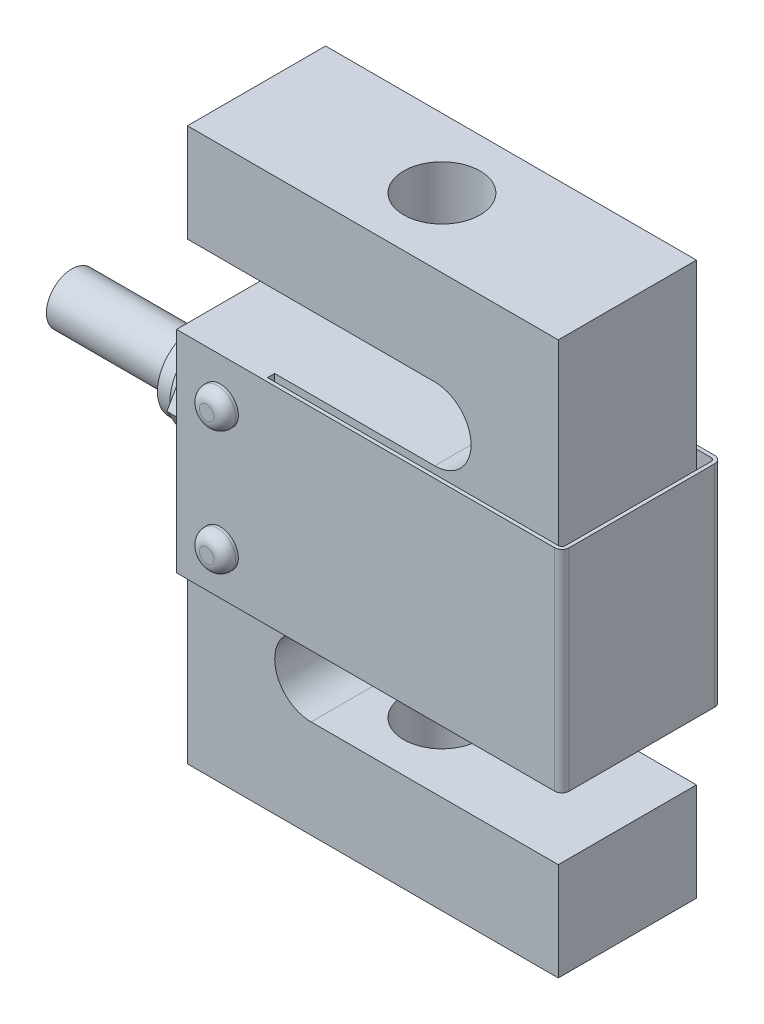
SolidWorks part; units mm, degrees
ref_plane "Plan de face" through (0, 0, 0) normal (0, 0, 1) x (1, 0, 0)
ref_plane "Plan de dessus" through (0, 0, 0) normal (0, 1, 0) x (1, 0, 0)
ref_plane "Plan de droite" through (0, 0, 0) normal (1, 0, 0) x (0, 0, -1)
sketch "Esquisse1" plane through (0, 0, 0) normal (0, 0, 1) x (1, 0, 0)
  line L0 (-25.5, 0) -> (25.5, 0)
  line L1 (25.5, 0) -> (25.5, 13.5)
  line L2 (25.5, 13.5) -> (-8.5, 13.5)
  line L4 (-8.5, 23.5) -> (25.5, 23.5)
  line L5 (25.5, 23.5) -> (25.5, 76)
  line L6 (25.5, 76) -> (-25.5, 76)
  line L7 (-25.5, 76) -> (-25.5, 62.5)
  line L8 (-25.5, 62.5) -> (8.5, 62.5)
  line L10 (8.5, 52.5) -> (-25.5, 52.5)
  line L11 (-25.5, 52.5) -> (-25.5, 0)
  arc A1 (8.5, 52.5) -> (8.5, 62.5) centre (8.5, 57.5) ccw
  arc A2 (-8.5, 23.5) -> (-8.5, 13.5) centre (-8.5, 18.5) ccw
  dimension "D1" = 76
  dimension "D2" = 13.5
  dimension "D3" = 13.5
  dimension "D4" = 10
  dimension "D6" = 51
  dimension "D7" = 51
  dimension "D8" = 25.5
  dimension "D9" = 17
  dimension "D10" = 17
extrude "Extrusion1" add sketch "Esquisse1" along normal mid plane 19
hole_wizard "Trou taraudé M12x1.51" positions "Esquisse3" profile "Esquisse2" tap size "M12x1.5" standard "ISO"
sketch "Esquisse3" plane through (0, 0, 0) normal (0, -1, 0) x (1, 0, 0)
  point P0 (0, 0)
sketch "Esquisse2" plane through (0, 0, 0) normal (1, 0, 0) x (0, 0, -1)
  line L0 (0, 0) -> (0, 13.5)
  line L1 (0, 13.5) -> (5.25, 13.5)
  line L2 (5.25, 13.5) -> (5.25, 0)
  line L5 (5.25, 0) -> (0, 0)
  line L11 (0, -6.35) -> (0, 107.95) construction
  dimension "Diamètre du trou pour taraudage jusqu'au prochain" = 10.5
  dimension "Profondeur du trou pour taraudage jusqu'au prochain" = 13.5
hole_wizard "Trou taraudé M12x1.52" positions "Esquisse3D1" profile "Esquisse5" tap size "M12x1.5" standard "ISO"
sketch3d "Esquisse3D1"
  line L0 (0, 13.5, 0) -> (0, 0, 0) construction
  point P0 (0, 76, 0)
sketch "Esquisse5" plane through (0, 76, 0) normal (1, 0, 0) x (0, 0, 1)
  line L0 (0, 0) -> (0, 13.5)
  line L1 (0, 13.5) -> (5.25, 13.5)
  line L2 (5.25, 13.5) -> (5.25, 0)
  line L5 (5.25, 0) -> (0, 0)
  line L11 (0, -6.35) -> (0, 107.95) construction
  dimension "Diamètre du trou pour taraudage jusqu'au prochain" = 10.5
  dimension "Profondeur du trou pour taraudage jusqu'au prochain" = 13.5
sketch "Esquisse6" plane through (0, 52.5, 0) normal (0, 1, 0) x (-1, 0, 0)
  line L0 (25.5, 9.5) -> (25.5, 11)
  line L1 (25.5, 11) -> (-26.5, 11)
  line L2 (-27.5, 10) -> (-27.5, -10)
  line L3 (-26.5, -11) -> (25.5, -11)
  line L4 (25.5, -11) -> (25.5, -9.5)
  line L5 (25.5, -9.5) -> (13.5, -9.5)
  line L6 (13.5, -9.5) -> (13.5, -10.5)
  line L7 (13.5, -10.5) -> (-26.5, -10.5)
  line L8 (-27, -10) -> (-27, 10)
  line L9 (-26.5, 10.5) -> (13.5, 10.5)
  line L10 (13.5, 10.5) -> (13.5, 9.5)
  line L11 (-8.5, 9.5) -> (25.5, 9.5) construction
  line L12 (13.5, 9.5) -> (25.5, 9.5)
  line L13 (-25.5, 9.5) -> (25.5, 9.5) construction
  line L14 (25.5, 9.5) -> (25.5, -9.5) construction
  arc A0 (-27, 10) -> (-26.5, 10.5) centre (-26.5, 10) cw
  arc A1 (-26.5, -10.5) -> (-27, -10) centre (-26.5, -10) cw
  arc A2 (-27.5, -10) -> (-26.5, -11) centre (-26.5, -10) ccw
  arc A3 (-26.5, 11) -> (-27.5, 10) centre (-26.5, 10) ccw
  dimension "D9" = 0.5
  dimension "D10" = 1
  dimension "D1" = 0.5
  dimension "D2" = 0.5
  dimension "D3" = 0.5
  dimension "D4" = 22
  dimension "D5" = 1.5
  dimension "D6" = 53
  dimension "D7" = 12
  dimension "D8" = 12
extrude "Extrusion2" add sketch "Esquisse6" against normal up to surface (29 mm away)
sketch "Esquisse7" plane through (-25.5, 0, 0) normal (-1, 0, 0) x (0, 0, 1)
  line L0 (11, 52.5) -> (-11, 52.5) construction
  circle A0 centre (0, 38) radius 5.5
  dimension "D1" = 11
  dimension "D2" = 14.5
extrude "Extrusion3" add sketch "Esquisse7" along normal blind 1
sketch "Esquisse8" plane through (-26.5, 0, 0) normal (-1, 0, 0) x (0, 0, 1)
  line L0 (11, 52.5) -> (-11, 52.5) construction
  line L1 (3.4641, 32) -> (6.9282, 38)
  line L2 (6.9282, 38) -> (3.4641, 44)
  line L3 (3.4641, 44) -> (-3.4641, 44)
  line L4 (-3.4641, 44) -> (-6.9282, 38)
  line L5 (-6.9282, 38) -> (-3.4641, 32)
  line L6 (-3.4641, 32) -> (3.4641, 32)
  circle A0 centre (0, 38) radius 6 construction
  dimension "D1" = 12
extrude "Extrusion4" add sketch "Esquisse8" along normal blind 4.4
sketch "Esquisse9" plane through (-30.9, 0, 0) normal (-1, 0, 0) x (0, 0, 1)
  circle A0 centre (0, 38) radius 5.5
  circle A1 centre (0, 38) radius 5.5 construction
extrude "Extrusion5" add sketch "Esquisse9" along normal blind 1
sketch "Esquisse10" plane through (-31.9, 0, 0) normal (-1, 0, 0) x (0, 0, 1)
  circle A0 centre (0, 38) radius 5.225
  circle A1 centre (0, 38) radius 5.5 construction
  dimension "D1" = 10.45
extrude "Extrusion6" add sketch "Esquisse10" along normal blind 2
sketch "Esquisse11" plane through (-33.9, 0, 0) normal (-1, 0, 0) x (0, 0, 1)
  circle A0 centre (0, 38) radius 3.5
  circle A1 centre (0, 38) radius 5.225 construction
  dimension "D1" = 7
extrude "Extrusion7" add sketch "Esquisse11" along normal blind 17
sketch "Esquisse12" plane through (0, 0, 11) normal (0, 0, 1) x (1, 0, 0)
  line L0 (-25.5, 52.5) -> (26.5, 52.5) construction
  line L1 (-25.5, 23.5) -> (-25.5, 52.5) construction
  circle A0 centre (-19.5, 46.5) radius 2.5
  circle A1 centre (-19.5, 29.5) radius 2.5
  dimension "D1" = 5
  dimension "D3" = 6
  dimension "D2" = 6
extrude "Extrusion8" add sketch "Esquisse12" along normal blind 1.86 and the other way blind 23.86
fillet "Congé1" radius 1.5 4 edges at (-17, 46.5, -12.86) (-17, 29.5, 12.86) (-17, 46.5, 12.86) (-17, 29.5, -12.86)
